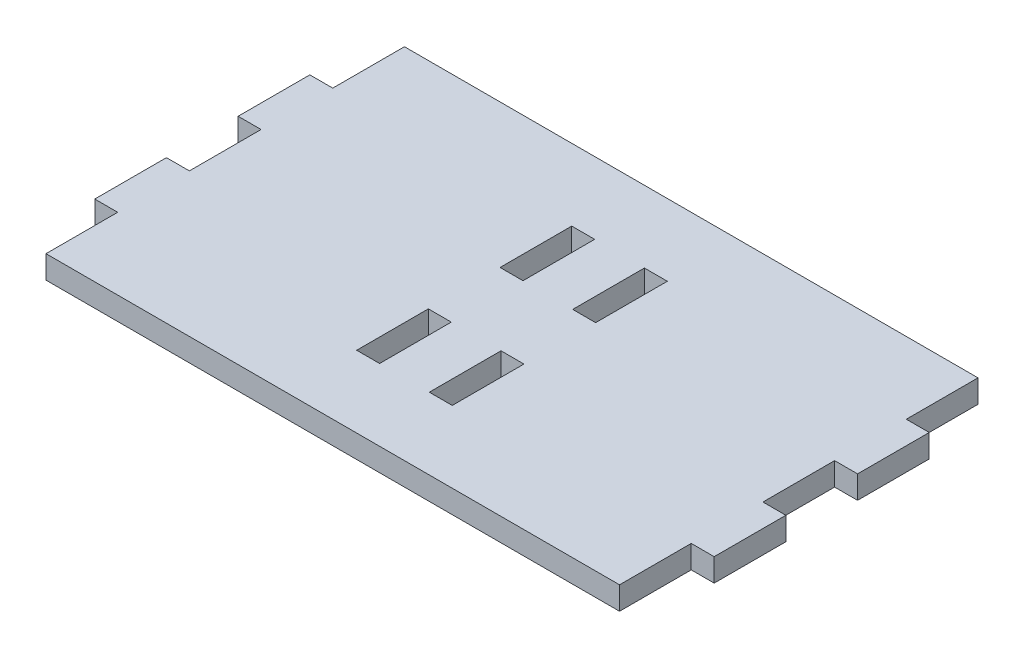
SolidWorks part; units mm, degrees
ref_plane "Alzado" through (0, 0, 0) normal (0, 0, 1) x (1, 0, 0)
ref_plane "Planta" through (0, 0, 0) normal (0, 1, 0) x (1, 0, 0)
ref_plane "Vista lateral" through (0, 0, 0) normal (1, 0, 0) x (0, 0, -1)
sketch "Croquis1" plane through (0, 0, 0) normal (0, 1, 0) x (1, 0, 0)
  line L0 (-162, 18.75) -> (-162, 56.25)
  line L1 (-150, -93.75) -> (150, -93.75)
  line L2 (-150, -93.75) -> (-150, -56.25)
  line L3 (-150, 93.75) -> (150, 93.75)
  line L5 (-150, -93.75) -> (150, 93.75) construction
  line L6 (-150, 93.75) -> (150, -93.75) construction
  line L7 (-150, -56.25) -> (-162, -56.25)
  line L9 (-150, -18.75) -> (-162, -18.75)
  line L10 (-162, -56.25) -> (-162, -18.75)
  line L11 (-150, 56.25) -> (-162, 56.25)
  line L13 (-150, 18.75) -> (-162, 18.75)
  line L18 (0, 93.75) -> (0, 142.0008) construction
  line L31 (-150, 56.25) -> (-150, 93.75)
  line L32 (150, -93.75) -> (150, -56.25)
  line L34 (150, 56.25) -> (150, 93.75)
  line L35 (-150, -18.75) -> (-150, 18.75)
  line L39 (150, -18.75) -> (150, 18.75)
  line L40 (150, 18.75) -> (162, 18.75)
  line L41 (150, 56.25) -> (162, 56.25)
  line L42 (162, -56.25) -> (162, -18.75)
  line L43 (150, -18.75) -> (162, -18.75)
  line L44 (150, -56.25) -> (162, -56.25)
  line L45 (162, 18.75) -> (162, 56.25)
  line L46 (-25, -18.75) -> (-25, -56.25)
  line L47 (-25, 56.25) -> (-13, 56.25)
  line L48 (-25, 56.25) -> (-25, 18.75)
  line L49 (-25, 18.75) -> (-13, 18.75)
  line L50 (-13, 56.25) -> (-13, 18.75)
  line L51 (-25, -56.25) -> (-13, -56.25)
  line L52 (-13, -18.75) -> (-13, -56.25)
  line L53 (-25, -18.75) -> (-13, -18.75)
  line L54 (25, -18.75) -> (13, -18.75)
  line L55 (13, -18.75) -> (13, -56.25)
  line L56 (25, -56.25) -> (13, -56.25)
  line L57 (25, -18.75) -> (25, -56.25)
  line L58 (25, 56.25) -> (13, 56.25)
  line L59 (13, 56.25) -> (13, 18.75)
  line L60 (25, 18.75) -> (13, 18.75)
  line L61 (25, 56.25) -> (25, 18.75)
  point P0 (0, 0)
extrude "Saliente-Extruir1" add sketch "Croquis1" along normal blind 12
equation "\"ancho\"= \"ancho_joint\" * 5"
equation "\"alto\"= 30"
equation "\"material\"= 1.2"
equation "\"ancho_joint_sep\"=3.75"
equation "\"ancho_joint\"=3.75"
equation "\"D4@Croquis1\"=\"ancho_joint\""
equation "\"D5@Croquis1\"=\"material\""
equation "\"D3@Croquis1\"=\"ancho_joint\""
equation "\"D7@Croquis1\"=\"ancho_joint\""
equation "\"D8@Croquis1\"=\"ancho_joint\""
equation "\"D1@Croquis1\"=\"alto\""
equation "\"D2@Croquis1\"=\"ancho_joint\""
equation "\"D9@Croquis1\"=\"material\""
equation "\"D11@Croquis1\"=\"ancho_joint\""
equation "\"D13@Croquis1\"=\"ancho_joint\""
equation "\"D1@Saliente-Extruir1\"=\"material\""
